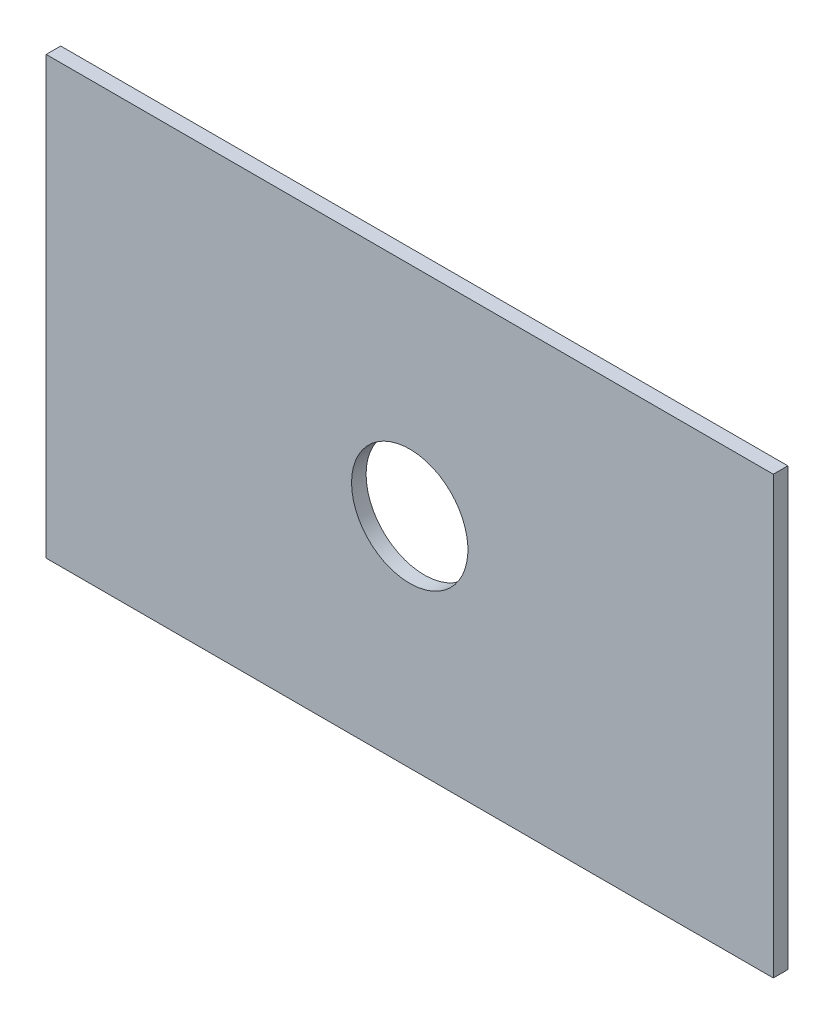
SolidWorks part; units mm, degrees
ref_plane "Piano frontale" through (0, 0, 0) normal (0, 0, 1) x (1, 0, 0)
ref_plane "Piano superiore" through (0, 0, 0) normal (0, 1, 0) x (1, 0, 0)
ref_plane "Piano destro" through (0, 0, 0) normal (1, 0, 0) x (0, 0, -1)
sketch "Schizzo1" plane through (0, 0, 0) normal (0, 0, 1) x (1, 0, 0)
  line L1 (-25, -15) -> (25, -15)
  line L2 (-25, -15) -> (-25, 15)
  line L3 (-25, 15) -> (25, 15)
  line L4 (25, -15) -> (25, 15)
  line L5 (-25, -15) -> (25, 15) construction
  line L6 (-25, 15) -> (25, -15) construction
  circle A0 centre (0, 0) radius 4
  point P0 (0, 0)
  dimension "D3" = 8
  dimension "D1" = 50
  dimension "D2" = 30
extrude "Estrusione-Estrusione1" add sketch "Schizzo1" along normal blind 1
